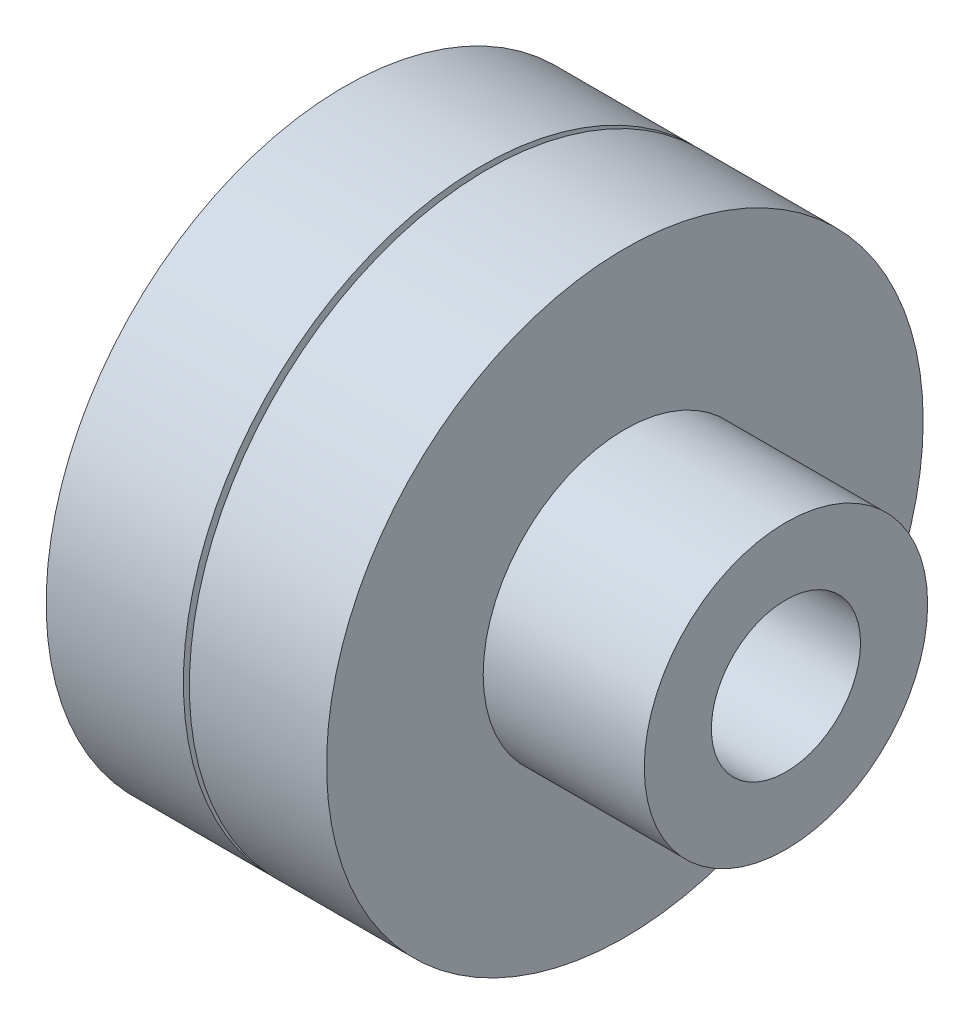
SolidWorks part; units mm, degrees
ref_plane "Front Plane" through (0, 0, 0) normal (0, 0, 1) x (1, 0, 0)
ref_plane "Top Plane" through (0, 0, 0) normal (0, 1, 0) x (1, 0, 0)
ref_plane "Right Plane" through (0, 0, 0) normal (1, 0, 0) x (0, 0, -1)
sketch "Sketch1" plane through (0, 0, 0) normal (0, 0, 1) x (1, 0, 0)
  line L0 (-167, -30) -> (-102, -30)
  line L1 (-167, -47.5) -> (-148, -47.5)
  line L2 (-167, -47.5) -> (-167, -30)
  line L3 (0, 0) -> (-63.8148, 0) construction
  line L4 (0, -47.5) -> (0, -25)
  line L7 (-148, -47.5) -> (-148, -100)
  line L8 (-148, -100) -> (-102, -100)
  line L9 (-54, -100) -> (-54, -47.5)
  line L10 (-54, -47.5) -> (0, -47.5)
  line L11 (-100, -25) -> (0, -25)
  line L12 (-100, -100) -> (-100, -25)
  line L13 (-102, -100) -> (-102, -30)
  line L14 (-100, -100) -> (-54, -100)
  dimension "D1" = 167
  dimension "D2" = 30
  dimension "D3" = 47.5
  dimension "D4" = 25
  dimension "D6" = 100
  dimension "D7" = 19
  dimension "D8" = 94
  dimension "D9" = 2
  dimension "D10" = 46
revolve "Revolve1" add sketch "Sketch1" angle 360 about L3
